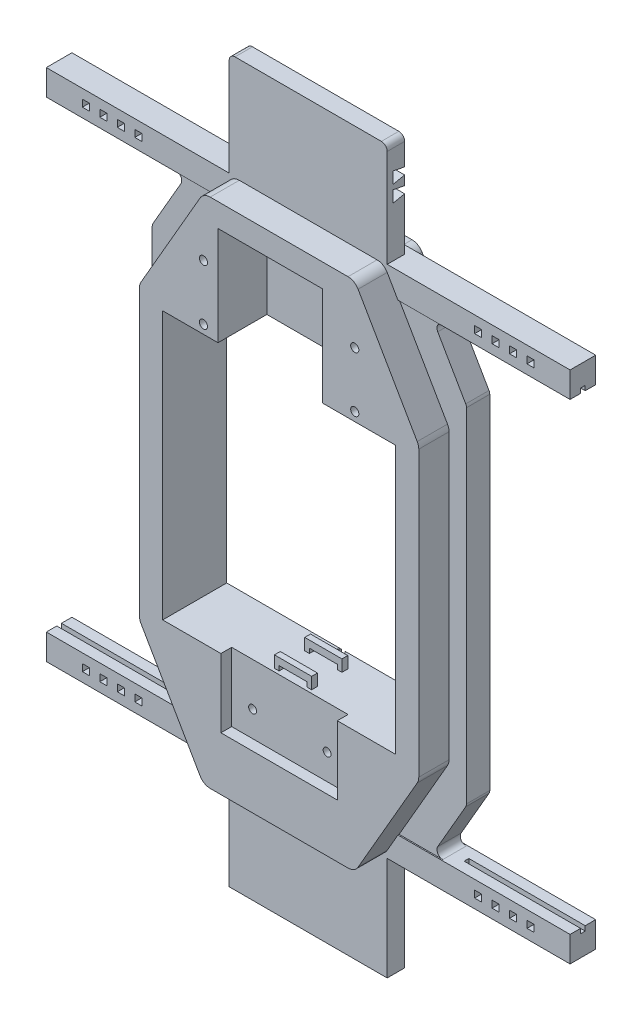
SolidWorks part; units mm, degrees
ref_plane "前视基准面" through (0, 0, 0) normal (0, 0, 1) x (1, 0, 0)
ref_plane "上视基准面" through (0, 0, 0) normal (0, 1, 0) x (1, 0, 0)
ref_plane "右视基准面" through (0, 0, 0) normal (1, 0, 0) x (0, 0, -1)
sketch "草图1" plane through (0, 0, 0) normal (0, 0, 1) x (1, 0, 0)
  line L0 (-98.6603, 121.6667) -> (-56.3212, 195)
  line L1 (47.661, 200) -> (-47.661, 200)
  line L2 (100, 116.6667) -> (100, -116.6667)
  line L3 (47.661, -200) -> (-47.661, -200)
  line L4 (-100, 116.6667) -> (-100, -116.6667)
  line L5 (-118.6603, 127.0257) -> (-67.8682, 215)
  line L6 (59.208, 220) -> (-59.208, 220)
  line L7 (0, 0) -> (0, 150) construction
  line L8 (0, 0) -> (100, 0) construction
  line L9 (98.6603, 121.6667) -> (56.3212, 195)
  line L10 (98.6603, -121.6667) -> (56.3212, -195)
  line L11 (-98.6603, -121.6667) -> (-56.3212, -195)
  line L12 (118.6603, 127.0257) -> (67.8682, 215)
  line L13 (120, 122.0257) -> (120, -122.0257)
  line L14 (118.6603, -127.0257) -> (67.8682, -215)
  line L15 (59.208, -220) -> (-59.208, -220)
  line L16 (-118.6603, -127.0257) -> (-67.8682, -215)
  line L17 (-120, 122.0257) -> (-120, -122.0257)
  line L18 (-120, -124.7051) -> (-64.9815, -220) construction
  line L19 (-120, 124.7051) -> (-120, -124.7051) construction
  line L20 (64.9815, -220) -> (-64.9815, -220) construction
  line L21 (120, -124.7051) -> (64.9815, -220) construction
  line L22 (120, 124.7051) -> (120, -124.7051) construction
  line L23 (-100, -119.3462) -> (-53.4345, -200) construction
  line L24 (53.4345, -200) -> (-53.4345, -200) construction
  line L25 (-100, 119.3462) -> (-100, -119.3462) construction
  line L26 (100, -119.3462) -> (53.4345, -200) construction
  line L27 (100, 119.3462) -> (100, -119.3462) construction
  line L28 (100, 119.3462) -> (53.4345, 200) construction
  line L29 (53.4345, 200) -> (-53.4345, 200) construction
  line L30 (-100, 119.3462) -> (-53.4345, 200) construction
  line L31 (120, 124.7051) -> (64.9815, 220) construction
  line L32 (64.9815, 220) -> (-64.9815, 220) construction
  line L33 (-120, 124.7051) -> (-64.9815, 220) construction
  arc A0 (-118.6603, -127.0257) -> (-120, -122.0257) centre (-110, -122.0257) cw
  arc A1 (-59.208, -220) -> (-67.8682, -215) centre (-59.208, -210) cw
  arc A2 (67.8682, -215) -> (59.208, -220) centre (59.208, -210) cw
  arc A3 (120, -122.0257) -> (118.6603, -127.0257) centre (110, -122.0257) cw
  arc A4 (-56.3212, -195) -> (-47.661, -200) centre (-47.661, -190) ccw
  arc A5 (-98.6603, -121.6667) -> (-100, -116.6667) centre (-90, -116.6667) cw
  arc A6 (56.3212, -195) -> (47.661, -200) centre (47.661, -190) cw
  arc A7 (98.6603, -121.6667) -> (100, -116.6667) centre (90, -116.6667) ccw
  arc A8 (56.3212, 195) -> (47.661, 200) centre (47.661, 190) ccw
  arc A9 (98.6603, 121.6667) -> (100, 116.6667) centre (90, 116.6667) cw
  arc A10 (-56.3212, 195) -> (-47.661, 200) centre (-47.661, 190) cw
  arc A11 (-98.6603, 121.6667) -> (-100, 116.6667) centre (-90, 116.6667) ccw
  arc A12 (118.6603, 127.0257) -> (120, 122.0257) centre (110, 122.0257) cw
  arc A13 (59.208, 220) -> (67.8682, 215) centre (59.208, 210) cw
  arc A14 (-67.8682, 215) -> (-59.208, 220) centre (-59.208, 210) cw
  arc A15 (-118.6603, 127.0257) -> (-120, 122.0257) centre (-110, 122.0257) ccw
  point P0 (0, 0)
  point P37 (-53.4345, -200)
  point P50 (53.4345, 200)
  dimension "D6" = 10
  dimension "D7" = 73.3333
  dimension "D1" = 400
  dimension "D2" = 200
  dimension "D3" = 100
  dimension "D4" = 200
  dimension "D5" = 20
  dimension "D8" = 30
  dimension "D9" = 73.3333
  dimension "D10" = 30
extrude "凸台-拉伸1" add sketch "草图1" along normal blind 30
sketch "草图2" plane through (0, 0, 30) normal (0, 0, 1) x (1, 0, 0)
  line L0 (-100, 130) -> (-70, 130)
  line L1 (-100, 116.6667) -> (-100, -116.6667) construction
  line L2 (-70, 130) -> (-70, 200)
  line L3 (47.661, 200) -> (-47.661, 200) construction
  line L4 (-70, 200) -> (-37.5, 200)
  line L5 (-37.5, 200) -> (-37.5, 115)
  line L6 (-37.5, 115) -> (-100, 115)
  line L7 (-100, 115) -> (-100, 130)
  line L8 (0, 0) -> (0, 200) construction
  dimension "D1" = 15
  dimension "D2" = 32.5
  dimension "D3" = 37.5
  dimension "D4" = 115
extrude "凸台-拉伸2" add sketch "草图2" against normal blind 40
mirror "镜向1" about plane through (0, 0, 0) normal (0, 1, 0) of "凸台-拉伸2"
mirror "镜向2" about plane through (0, 0, 0) normal (1, 0, 0) of "凸台-拉伸2", "镜向1"
sketch "草图3" plane through (0, 0, 0) normal (0, 0, -1) x (-1, 0, 0)
  line L0 (-100, 115) -> (100, 115)
  line L1 (100, 115) -> (100, -115)
  line L2 (100, -115) -> (-100, -115)
  line L3 (-100, -115) -> (-100, 115)
  line L8 (120, -122.0257) -> (120, 122.0257)
  line L10 (120, -122.0257) -> (120, 122.0257)
  line L12 (-120, 122.0257) -> (-120, -122.0257)
  line L13 (-118.6603, -127.0257) -> (-67.8682, -215)
  line L14 (118.6603, 127.0257) -> (67.8682, 215)
  line L20 (-120, 122.0257) -> (-120, -122.0257)
  line L21 (-118.6603, -127.0257) -> (-67.8682, -215)
  line L28 (118.6603, 127.0257) -> (67.8682, 215)
  line L29 (59.208, 220) -> (-59.208, 220)
  line L30 (59.208, 220) -> (-59.208, 220)
  line L31 (-67.8682, 215) -> (-118.6603, 127.0257)
  line L32 (-67.8682, 215) -> (-118.6603, 127.0257)
  line L34 (-59.208, -220) -> (59.208, -220)
  line L36 (-59.208, -220) -> (59.208, -220)
  line L38 (67.8682, -215) -> (118.6603, -127.0257)
  line L40 (67.8682, -215) -> (118.6603, -127.0257)
  arc A8 (118.6603, -127.0257) -> (120, -122.0257) centre (110, -122.0257) ccw
  arc A9 (118.6603, -127.0257) -> (120, -122.0257) centre (110, -122.0257) ccw
  arc A10 (120, 122.0257) -> (118.6603, 127.0257) centre (110, 122.0257) ccw
  arc A11 (120, 122.0257) -> (118.6603, 127.0257) centre (110, 122.0257) ccw
  arc A12 (-118.6603, 127.0257) -> (-120, 122.0257) centre (-110, 122.0257) ccw
  arc A13 (-120, -122.0257) -> (-118.6603, -127.0257) centre (-110, -122.0257) ccw
  arc A14 (67.8682, 215) -> (59.208, 220) centre (59.208, 210) ccw
  arc A15 (67.8682, 215) -> (59.208, 220) centre (59.208, 210) ccw
  arc A20 (-118.6603, 127.0257) -> (-120, 122.0257) centre (-110, 122.0257) ccw
  arc A21 (-120, -122.0257) -> (-118.6603, -127.0257) centre (-110, -122.0257) ccw
  arc A24 (-59.208, 220) -> (-67.8682, 215) centre (-59.208, 210) ccw
  arc A25 (-59.208, 220) -> (-67.8682, 215) centre (-59.208, 210) ccw
  arc A26 (-67.8682, -215) -> (-59.208, -220) centre (-59.208, -210) ccw
  arc A27 (-67.8682, -215) -> (-59.208, -220) centre (-59.208, -210) ccw
  arc A28 (59.208, -220) -> (67.8682, -215) centre (59.208, -210) ccw
  arc A29 (59.208, -220) -> (67.8682, -215) centre (59.208, -210) ccw
  dimension "D1" = 0
extrude "凸台-拉伸3" add sketch "草图3" along normal blind 20
sketch "草图5" plane through (0, 0, -20) normal (0, 0, -1) x (-1, 0, 0)
  line L0 (-67.8682, 215) -> (-67.8682, 310)
  line L1 (-67.8682, 310) -> (67.8682, 310)
  line L2 (67.8682, 310) -> (67.8682, 215)
  line L3 (59.208, 220) -> (-59.208, 220) construction
  line L4 (59.208, 220) -> (-59.208, 220)
  arc A0 (67.8682, 215) -> (59.208, 220) centre (59.208, 210) ccw construction
  arc A1 (-59.208, 220) -> (-67.8682, 215) centre (-59.208, 210) ccw construction
  arc A2 (67.8682, 215) -> (59.208, 220) centre (59.208, 210) ccw
  arc A3 (-59.208, 220) -> (-67.8682, 215) centre (-59.208, 210) ccw
  dimension "D1" = 90
extrude "凸台-拉伸11" add sketch "草图5" against normal blind 15 from offset 10
fillet "圆角3" radius 5 2 edges at (67.8682, 310, -2.5) (-67.8682, 310, -2.5)
sketch "草图6" plane through (0, 0, 0) normal (1, 0, 0) x (0, 0, -1)
  line L0 (-30, 220) -> (-5, 220) construction
  line L1 (17, 221) -> (-5, 221)
  line L2 (17, 221) -> (17, 199)
  line L3 (17, 199) -> (-5, 199)
  line L4 (-5, 221) -> (-5, 199)
  line L5 (17, 221) -> (-5, 199) construction
  line L6 (17, 199) -> (-5, 221) construction
  line L7 (-30, 127.0257) -> (-30, 215) construction
  point P0 (6, 210)
  dimension "D1" = 22
  dimension "D2" = 10
  dimension "D3" = 22
  dimension "D4" = 25
extrude "凸台-拉伸12" add sketch "草图6" along normal mid plane 450
sketch "草图10" plane through (0, 0, 30) normal (0, 0, 1) x (1, 0, 0)
  line L0 (-65, 122.5) -> (-65, 170) construction
  line L2 (-100, 115) -> (-37.5, 115) construction
  dimension "D1" = 65
  dimension "D2" = 7.5
  dimension "D3" = 47.5
hole_wizard "M8x1.0 螺纹孔1" positions "3D草图1" profile "草图11" tap size "M8x1.0" standard "GB"
sketch3d "3D草图1"
  point P0 (-65, 122.5, 30)
  point P3 (-65, 170, 30)
sketch "草图11" plane through (-65, 122.5, 30) normal (1, 0, 0) x (0, -1, 0)
  line L0 (0, 0) -> (0, 23.103)
  line L1 (0, 23.103) -> (3.5, 21)
  line L2 (3.5, 21) -> (3.5, 0)
  line L5 (3.5, 0) -> (0, 0)
  line L10 (0, 23.103) -> (-3.5, 21) construction
  line L11 (0, -6.35) -> (0, 107.95) construction
  dimension "螺纹孔钻头直径" = 7
  dimension "螺纹孔钻头深度" = 21
  dimension "导头角度" = 118
mirror "镜向7" about plane through (0, 0, 0) normal (1, 0, 0) of "M8x1.0 螺纹孔1"
sketch "草图14" plane through (0, 0, 0) normal (0, 0, 1) x (1, 0, 0)
  line L0 (-37.5, 200) -> (37.5, 200)
  line L1 (37.5, 200) -> (37.5, 199)
  line L2 (37.5, 199) -> (-37.5, 199)
  line L3 (-37.5, 199) -> (-37.5, 200)
extrude "切除-拉伸1" cut sketch "草图14" along normal blind 10
mirror "镜向8" about plane through (0, 0, 0) normal (0, 1, 0) of "凸台-拉伸11", "切除-拉伸1", "凸台-拉伸12"
sketch "草图15" plane through (0, 0, 5) normal (0, 0, 1) x (1, 0, 0)
  line L0 (225, 210) -> (191, 210) construction
  line L1 (194, 213) -> (188, 213)
  line L2 (194, 213) -> (194, 207)
  line L3 (194, 207) -> (188, 207)
  line L4 (188, 213) -> (188, 207)
  line L5 (194, 213) -> (188, 207) construction
  line L6 (194, 207) -> (188, 213) construction
  line L7 (225, 221) -> (225, 199) construction
  line L8 (191, 210) -> (176, 210) construction
  line L10 (179, 213) -> (173, 213)
  line L11 (179, 213) -> (179, 207)
  line L12 (179, 207) -> (173, 207)
  line L13 (173, 213) -> (173, 207)
  line L14 (179, 213) -> (173, 207) construction
  line L15 (179, 207) -> (173, 213) construction
  point P0 (191, 210)
  dimension "D1" = 6
  dimension "D2" = 6
  dimension "D3" = 34
  dimension "D4" = 15
  dimension "D5" = 6
  dimension "D6" = 6
extrude "切除-拉伸2" cut sketch "草图15" against normal blind 10
pattern_linear "阵列(线性)1" count 2 spacing 30 along (-1, 0, 0) of "切除-拉伸2"
sketch "草图16" plane through (0, 0, 5) normal (0, 0, 1) x (1, 0, 0)
  line L0 (135, 199) -> (135, -199)
  line L1 (225, 199) -> (77.1058, 199) construction
  line L2 (225, -199) -> (77.1058, -199) construction
  line L3 (135, -199) -> (77.1058, -199)
  line L4 (77.1058, -199) -> (118.6603, -127.0257)
  line L5 (120, -122.0257) -> (120, 122.0257) construction
  line L6 (120, -122.0257) -> (120, 122.0257)
  line L7 (118.6603, 127.0257) -> (67.8682, 215) construction
  line L8 (118.6603, 127.0257) -> (77.1058, 199)
  line L9 (135, 199) -> (77.1058, 199)
  line L10 (0, 0) -> (0, -200) construction
  line L11 (-37.5, -200) -> (37.5, -200) construction
  line L12 (-135, 199) -> (-77.1058, 199)
  line L13 (-118.6603, 127.0257) -> (-77.1058, 199)
  line L14 (-120, -122.0257) -> (-120, 122.0257)
  line L15 (-77.1058, -199) -> (-118.6603, -127.0257)
  line L16 (-135, -199) -> (-77.1058, -199)
  line L17 (-135, 199) -> (-135, -199)
  arc A0 (118.6603, -127.0257) -> (120, -122.0257) centre (110, -122.0257) ccw construction
  arc A1 (118.6603, -127.0257) -> (120, -122.0257) centre (110, -122.0257) ccw
  arc A2 (120, 122.0257) -> (118.6603, 127.0257) centre (110, 122.0257) ccw construction
  arc A3 (120, 122.0257) -> (118.6603, 127.0257) centre (110, 122.0257) ccw
  arc A4 (-120, 122.0257) -> (-118.6603, 127.0257) centre (-110, 122.0257) cw
  arc A5 (-118.6603, -127.0257) -> (-120, -122.0257) centre (-110, -122.0257) cw
  dimension "D1" = 15
extrude "凸台-拉伸13" add sketch "草图16" against normal blind 20 from offset 1
sketch "草图17" plane through (0, 0, 4) normal (0, 0, 1) x (1, 0, 0)
  line L0 (105.9734, 199) -> (135, 148.7244)
  line L1 (135, 199) -> (77.1058, 199) construction
  line L2 (135, -199) -> (135, 199) construction
  line L3 (135, 148.7244) -> (135, 199)
  line L4 (225, 199) -> (77.1058, 199) construction
  line L5 (135, 199) -> (105.9734, 199)
  line L6 (77.1058, 199) -> (118.6603, 127.0257) construction
  line L7 (118.6603, 127.0257) -> (67.8682, 215) construction
  line L8 (0, 0) -> (308.3014, 0) construction
  line L9 (135, -199) -> (105.9734, -199)
  line L10 (135, -148.7244) -> (135, -199)
  line L11 (105.9734, -199) -> (135, -148.7244)
  line L12 (0, 0) -> (0, -200) construction
  line L13 (-37.5, -200) -> (37.5, -200) construction
  line L14 (-105.9734, -199) -> (-135, -148.7244)
  line L15 (-135, -148.7244) -> (-135, -199)
  line L16 (-135, -199) -> (-105.9734, -199)
  line L17 (-135, 199) -> (-105.9734, 199)
  line L18 (-135, 148.7244) -> (-135, 199)
  line L19 (-105.9734, 199) -> (-135, 148.7244)
  dimension "D1" = 25
extrude "切除-拉伸3" cut sketch "草图17" against normal blind 20
fillet "圆角4" radius 5 8 edges at (105.9734, -199, -6) (135, -148.7244, -6) (135, 148.7244, -6) (105.9734, 199, -6) (-105.9734, 199, -6) (-135, 148.7244, -6) (-135, -148.7244, -6) (-105.9734, -199, -6)
sketch "草图18" plane through (225, 0, 0) normal (1, 0, 0) x (0, 0, -1)
  line L0 (-5, 199) -> (17, 199) construction
  line L1 (8, 203) -> (4, 203)
  line L2 (8, 203) -> (8, 195)
  line L3 (8, 195) -> (4, 195)
  line L4 (4, 203) -> (4, 195)
  line L5 (8, 203) -> (4, 195) construction
  line L6 (8, 195) -> (4, 203) construction
  point P0 (6, 199)
  dimension "D1" = 8
  dimension "D2" = 4
extrude "切除-拉伸4" cut sketch "草图18" against normal blind 100
mirror "镜向9" about plane through (0, 0, 0) normal (0, 1, 0) of "切除-拉伸2", "切除-拉伸4", "阵列(线性)1"
mirror "镜向11" about plane through (0, 0, 0) normal (1, 0, 0) of "镜向9", "切除-拉伸2", "阵列(线性)1", "切除-拉伸4"
sketch "草图19" plane through (0, 0, 30) normal (0, 0, 1) x (1, 0, 0)
  line L3 (-93.849, 130) -> (-70, 130)
  line L4 (-70, 130) -> (-70, 171.3077)
  line L5 (-70, 171.3077) -> (-93.849, 130)
  line L6 (-93.849, 130) -> (-70, 130)
  line L7 (-70, 130) -> (-70, 171.3077)
  line L8 (-70, 171.3077) -> (-93.849, 130)
  line L9 (93.849, 130) -> (70, 171.3077)
  line L10 (70, 171.3077) -> (70, 130)
  line L11 (70, 130) -> (93.849, 130)
  line L12 (93.849, 130) -> (70, 171.3077)
  line L13 (70, 171.3077) -> (70, 130)
  line L14 (70, 130) -> (93.849, 130)
  line L15 (93.849, -130) -> (70, -130)
  line L16 (70, -130) -> (70, -171.3077)
  line L17 (70, -171.3077) -> (93.849, -130)
  line L18 (93.849, -130) -> (70, -130)
  line L19 (70, -130) -> (70, -171.3077)
  line L20 (70, -171.3077) -> (93.849, -130)
  line L21 (-93.849, -130) -> (-70, -171.3077)
  line L22 (-70, -171.3077) -> (-70, -130)
  line L23 (-70, -130) -> (-93.849, -130)
  line L24 (-93.849, -130) -> (-70, -171.3077)
  line L25 (-70, -171.3077) -> (-70, -130)
  line L26 (-70, -130) -> (-93.849, -130)
  dimension "D1" = 0
  dimension "D2" = 0
  dimension "D3" = 0
  dimension "D4" = 0
extrude "凸台-拉伸14" add sketch "草图19" against normal up to next
sketch "草图20" plane through (0, 0, -20) normal (0, 0, -1) x (-1, 0, 0)
  line L1 (-100, 115) -> (100, 115)
  line L2 (-100, 115) -> (-100, -115)
  line L3 (-100, -115) -> (100, -115)
  line L4 (100, 115) -> (100, -115)
  line L8 (120, -122.0257) -> (120, 122.0257)
  line L9 (118.6603, 127.0257) -> (67.8682, 215)
  line L10 (59.208, 220) -> (-59.208, 220)
  line L11 (-67.8682, 215) -> (-118.6603, 127.0257)
  line L12 (-120, 122.0257) -> (-120, -122.0257)
  line L13 (-118.6603, -127.0257) -> (-67.8682, -215)
  line L14 (-59.208, -220) -> (59.208, -220)
  line L15 (67.8682, -215) -> (118.6603, -127.0257)
  line L16 (120, -122.0257) -> (120, 122.0257)
  line L17 (118.6603, 127.0257) -> (67.8682, 215)
  line L18 (59.208, 220) -> (-59.208, 220)
  line L19 (-67.8682, 215) -> (-118.6603, 127.0257)
  line L20 (-120, 122.0257) -> (-120, -122.0257)
  line L21 (-118.6603, -127.0257) -> (-67.8682, -215)
  line L22 (-59.208, -220) -> (59.208, -220)
  line L23 (67.8682, -215) -> (118.6603, -127.0257)
  arc A8 (118.6603, -127.0257) -> (120, -122.0257) centre (110, -122.0257) ccw
  arc A9 (120, 122.0257) -> (118.6603, 127.0257) centre (110, 122.0257) ccw
  arc A10 (67.8682, 215) -> (59.208, 220) centre (59.208, 210) ccw
  arc A11 (-59.208, 220) -> (-67.8682, 215) centre (-59.208, 210) ccw
  arc A12 (-118.6603, 127.0257) -> (-120, 122.0257) centre (-110, 122.0257) ccw
  arc A13 (-120, -122.0257) -> (-118.6603, -127.0257) centre (-110, -122.0257) ccw
  arc A14 (-67.8682, -215) -> (-59.208, -220) centre (-59.208, -210) ccw
  arc A15 (59.208, -220) -> (67.8682, -215) centre (59.208, -210) ccw
  arc A16 (118.6603, -127.0257) -> (120, -122.0257) centre (110, -122.0257) ccw
  arc A17 (120, 122.0257) -> (118.6603, 127.0257) centre (110, 122.0257) ccw
  arc A18 (67.8682, 215) -> (59.208, 220) centre (59.208, 210) ccw
  arc A19 (-59.208, 220) -> (-67.8682, 215) centre (-59.208, 210) ccw
  arc A20 (-118.6603, 127.0257) -> (-120, 122.0257) centre (-110, 122.0257) ccw
  arc A21 (-120, -122.0257) -> (-118.6603, -127.0257) centre (-110, -122.0257) ccw
  arc A22 (-67.8682, -215) -> (-59.208, -220) centre (-59.208, -210) ccw
  arc A23 (59.208, -220) -> (67.8682, -215) centre (59.208, -210) ccw
  dimension "D1" = 0
extrude "凸台-拉伸15" add sketch "草图20" along normal blind 5
sketch "草图22" plane through (67.8682, 0, 0) normal (1, 0, 0) x (0, 0, -1)
  line L0 (10, 305) -> (10, 221) construction
  line L1 (10, 262) -> (0, 262)
  line L2 (10, 262) -> (10, 290)
  line L3 (10, 290) -> (0, 290)
  line L4 (0, 262) -> (0, 290)
  line L5 (-5, 310) -> (10, 310) construction
  line L6 (0, 264) -> (10, 266)
  line L7 (10, 272) -> (0, 274)
  line L8 (0, 276) -> (10, 276) construction
  line L9 (10, 280) -> (0, 278)
  line L10 (0, 288) -> (10, 286)
  dimension "D1" = 10
  dimension "D2" = 28
  dimension "D3" = 20
  dimension "D4" = 4
  dimension "D5" = 4
  dimension "D6" = 2
  dimension "D7" = 10
extrude "切除-拉伸5" cut sketch "草图22" against normal blind 20 contours L2 L7 L4 L6 | L10 L4 L9 L2
mirror "镜向12" about plane through (0, 0, 0) normal (1, 0, 0) of "切除-拉伸5"
sketch "草图24" plane through (0, 0, 0) normal (0, 0, 1) x (1, 0, 0)
  line L4 (-37.5, -115) -> (-37.5, -200)
  line L6 (-37.5, -115) -> (-37.5, -200)
  line L7 (37.5, -115) -> (-37.5, -115)
  line L11 (37.5, -115) -> (-37.5, -115)
  line L13 (-37.5, -200) -> (37.5, -200)
  line L15 (-37.5, -200) -> (37.5, -200)
  line L16 (37.5, -200) -> (37.5, -115)
  line L17 (37.5, -200) -> (37.5, -115)
  dimension "D1" = 0
extrude "凸台-拉伸16" add sketch "草图24" along normal up to surface (30 mm away)
sketch "草图25" plane through (0, -115, 0) normal (0, 1, 0) x (1, 0, 0)
  line L0 (0, -30) -> (0, 22) construction
  line L1 (-100, -30) -> (100, -30) construction
  dimension "D1" = 52
hole_wizard "M8 螺纹孔1" positions "3D草图2" profile "草图26" tap size "M8" standard "GB"
sketch3d "3D草图2"
  point P0 (0, -115, -22)
sketch "草图26" plane through (0, -115, -22) normal (1, 0, 0) x (0, 0, 1)
  line L0 (0, 0) -> (0, 22.0429)
  line L1 (0, 22.0429) -> (3.4, 20)
  line L2 (3.4, 20) -> (3.4, 0)
  line L5 (3.4, 0) -> (0, 0)
  line L10 (0, 22.0429) -> (-3.4, 20) construction
  line L11 (0, -6.35) -> (0, 107.95) construction
  dimension "螺纹孔钻头直径" = 6.8
  dimension "螺纹孔钻头深度" = 20
  dimension "导头角度" = 118
sketch "草图27" plane through (0, 0, 30) normal (0, 0, 1) x (1, 0, 0)
  line L0 (-16, -115) -> (-16, -105)
  line L1 (-100, -115) -> (100, -115) construction
  line L2 (-16, -105) -> (16, -105)
  line L3 (0, -105) -> (0, -111) construction
  line L4 (12, -111) -> (-12, -111)
  line L5 (-12, -111) -> (-12, -115)
  line L6 (-12, -115) -> (-16, -115)
  line L7 (0, 0) -> (0, -105) construction
  line L8 (12, -115) -> (16, -115)
  line L9 (12, -111) -> (12, -115)
  line L10 (16, -115) -> (16, -105)
  dimension "D1" = 6
  dimension "D2" = 10
  dimension "D3" = 12
  dimension "D4" = 16
extrude "凸台-拉伸17" add sketch "草图27" against normal blind 5 from offset 12
pattern_linear "阵列(线性)2" count 2 spacing 26 along (0, 0, -1) of "凸台-拉伸17"
sketch "草图28" plane through (0, 0, 30) normal (0, 0, 1) x (1, 0, 0)
  line L0 (0, -115) -> (0, -152) construction
  line L1 (-100, -115) -> (100, -115) construction
  line L2 (0, -152) -> (-32, -152) construction
  line L3 (0, -152) -> (32, -152) construction
  dimension "D1" = 37
  dimension "D2" = 32
  dimension "D3" = 32
hole_wizard "M8 螺纹孔2" positions "3D草图3" profile "草图29" tap size "M8" standard "GB"
sketch3d "3D草图3"
  point P0 (-32, -152, 30)
  point P3 (32, -152, 30)
sketch "草图29" plane through (-32, -152, 30) normal (1, 0, 0) x (0, -1, 0)
  line L0 (0, 0) -> (0, 24.5429)
  line L1 (0, 24.5429) -> (3.4, 22.5)
  line L2 (3.4, 22.5) -> (3.4, 0)
  line L5 (3.4, 0) -> (0, 0)
  line L10 (0, 24.5429) -> (-3.4, 22.5) construction
  line L11 (0, -6.35) -> (0, 107.95) construction
  dimension "螺纹孔钻头直径" = 6.8
  dimension "螺纹孔钻头深度" = 22.5
  dimension "导头角度" = 118
sketch "草图30" plane through (-67.8682, 0, 0) normal (-1, 0, 0) x (0, 0, 1)
  line L0 (-10, -310) -> (-38.263, -300.579)
  line L1 (-57.2367, -297.5) -> (-125, -297.5)
  line L2 (-127.5, -295) -> (-127.5, -290)
  line L3 (-125, -287.5) -> (-10, -287.5)
  line L4 (-10, -221) -> (-10, -310) construction
  line L5 (-10, -287.5) -> (-10, -310)
  arc A0 (-38.263, -300.579) -> (-57.2367, -297.5) centre (-57.2367, -357.5) ccw
  arc A1 (-127.5, -290) -> (-125, -287.5) centre (-125, -290) cw
  arc A2 (-125, -297.5) -> (-127.5, -295) centre (-125, -295) cw
  point P10 (-47.5, -297.5)
  point P13 (-127.5, -287.5)
  point P16 (-127.5, -297.5)
  dimension "D5" = 60
  dimension "D6" = 2.5
  dimension "D1" = 12.5
  dimension "D2" = 10
  dimension "D3" = 117.5
  dimension "D4" = 80
sketch "草图32" plane through (0, 0, 30) normal (0, 0, 1) x (1, 0, 0)
  line L0 (-37.5, 200) -> (-52.5, 200)
  line L1 (-52.5, 200) -> (-52.5, 115)
  line L2 (-100, 115) -> (-37.5, 115) construction
  line L3 (-52.5, 115) -> (-37.5, 115)
  line L4 (-37.5, 115) -> (-37.5, 200)
  dimension "D1" = 15
extrude "切除-拉伸7" cut sketch "草图32" against normal up to surface (30 mm away)
sketch "草图33" plane through (0, 0, 0) normal (0, 0, 1) x (1, 0, 0)
  line L4 (37.5, 115) -> (37.5, 200)
  line L6 (-52.5, 200) -> (-52.5, 115)
  line L7 (-52.5, 115) -> (37.5, 115)
  line L10 (-52.5, 200) -> (-52.5, 115)
  line L11 (-52.5, 115) -> (37.5, 115)
  line L12 (37.5, 115) -> (37.5, 200)
  line L14 (37.5, 200) -> (-52.5, 200)
  line L15 (37.5, 200) -> (-52.5, 200)
  dimension "D1" = 0
extrude "切除-拉伸8" cut sketch "草图33" against normal blind 12
sketch "草图34" plane through (0, 0, 30) normal (0, 0, 1) x (1, 0, 0)
  line L0 (-100, -115) -> (100, -115) construction
  line L1 (-50, -115) -> (50, -115)
  line L2 (-50, -115) -> (-50, -174)
  line L3 (-50, -174) -> (50, -174)
  line L4 (50, -115) -> (50, -174)
  line L5 (0, -174) -> (0, -220) construction
  line L6 (59.208, -220) -> (-59.208, -220) construction
  dimension "D1" = 100
  dimension "D2" = 59
extrude "切除-拉伸9" cut sketch "草图34" against normal blind 9.25
